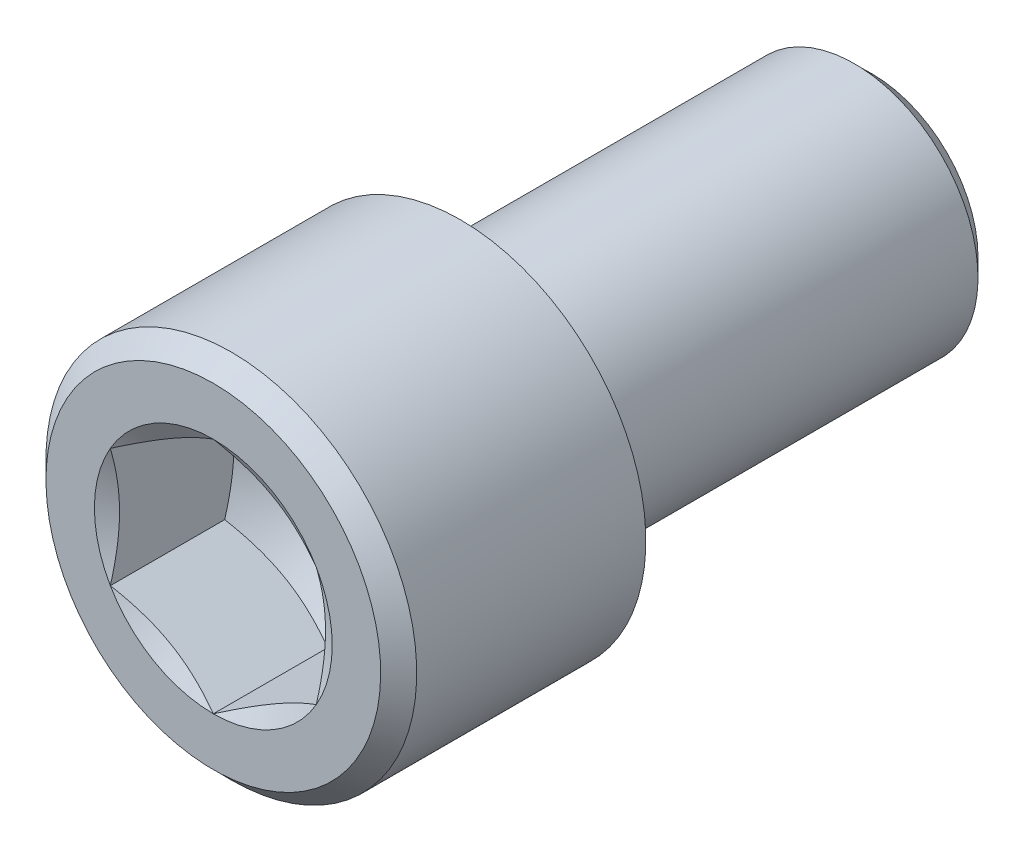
SolidWorks part; units mm, degrees
ref_plane "Front" through (0, 0, 0) normal (0, 0, 1) x (1, 0, 0)
ref_plane "Top" through (0, 0, 0) normal (0, 1, 0) x (1, 0, 0)
ref_plane "Right" through (0, 0, 0) normal (1, 0, 0) x (0, 0, -1)
sketch "Sketch1" plane through (0, 0, 0) normal (1, 0, 0) x (0, 0, -1)
  line L0 (0, 9) -> (-12, 9)
  line L1 (-12, 9) -> (-12, 0)
  line L2 (-12, 0) -> (20, 0)
  line L3 (20, 0) -> (20, 6)
  line L4 (20, 6) -> (0, 6)
  line L5 (0, 6) -> (0, 9)
  line L6 (0, 0) -> (12.7561, 0) construction
  dimension "l" = 20
  dimension "d" = 12
  dimension "k" = 12
  dimension "dk" = 18
revolve "Revolve1" add sketch "Sketch1" angle 360 about L2
sketch "Sketch7" plane through (0, 0, 0) normal (1, 0, 0) x (0, 0, -1)
  line L0 (-6.6396, 0) -> (3.6195, 0) construction
  line L1 (-12, 0) -> (-12, 5)
  line L2 (-12, 9) -> (-12, -9) construction
  line L3 (-12, 5) -> (-6, 5)
  line L4 (-6, 5) -> (-3.1132, 0)
  line L6 (-12, 0) -> (-3.1132, 0)
  dimension "D1" = 60
  dimension "S" = 10
  dimension "t" = 6
revolve "Cut-Revolve2" cut sketch "Sketch7" angle 360 about L6
chamfer "Chamfer1" distance 0.875 2 edges at (0, -6, -20) (0, -9, 12)
sketch "Sketch8" plane through (0, 0, 12) normal (0, 0, 1) x (1, 0, 0)
  line L1 (0, 5.7735) -> (-5, 2.8868)
  line L2 (-5, 2.8868) -> (-5, -2.8868)
  line L3 (-5, -2.8868) -> (0, -5.7735)
  line L4 (0, -5.7735) -> (5, -2.8868)
  line L5 (5, -2.8868) -> (5, 2.8868)
  line L6 (5, 2.8868) -> (0, 5.7735)
  circle A0 centre (0, 0) radius 5 construction
  circle A1 centre (0, 0) radius 5 construction
extrude "Cut-Extrude1" cut sketch "Sketch8" against normal up to surface (5.5534 mm away)
sketch "Sketch9" plane through (0, 0, 0) normal (1, 0, 0) x (0, 0, -1)
  line L0 (-12, 5) -> (4.2695, 5) construction
  line L3 (-12.5, 6.6395) -> (-12.5, 5)
  line L4 (-12.5, 5) -> (-11.5534, 5)
  line L5 (-11.5534, 5) -> (-12.5, 6.6395)
  line L6 (-12, 9) -> (-12, -9) construction
  dimension "D1" = 60
  dimension "D2" = 0.5
revolve "Cut-Revolve3" cut sketch "Sketch9" angle 360 about axis through (0, 0, 12) along (0, 0, -1)
fillet "Fillet2" radius 0.4 1 edges at (0, -6, 0)
